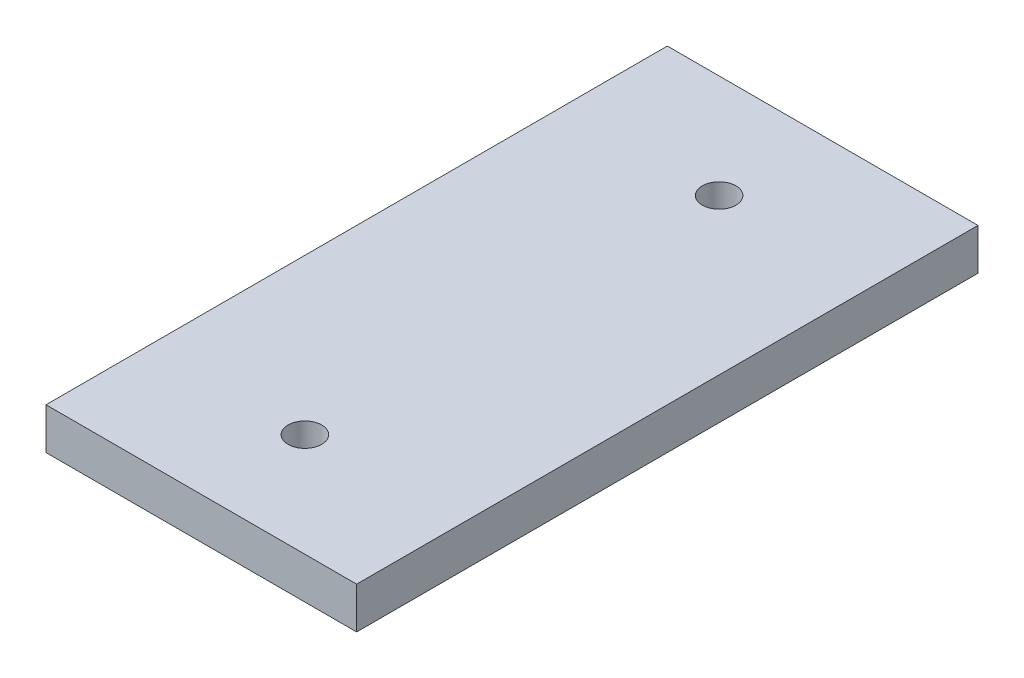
SolidWorks part; units mm, degrees
ref_plane "Face" through (0, 0, 0) normal (0, 0, 1) x (1, 0, 0)
ref_plane "Dessus" through (0, 0, 0) normal (0, 1, 0) x (1, 0, 0)
ref_plane "Droite" through (0, 0, 0) normal (1, 0, 0) x (0, 0, -1)
sketch "Esquisse1" plane through (0, 0, 0) normal (0, 0, 1) x (1, 0, 0)
  line L1 (0, 0) -> (60, 0)
  line L2 (0, 0) -> (0, -8)
  line L3 (0, -8) -> (60, -8)
  line L4 (60, 0) -> (60, -8)
  dimension "D1" = 60
  dimension "D2" = 8
extrude "Base-Extrusion" add sketch "Esquisse1" along normal blind 120
sketch "Esquisse2" plane through (0, 0, 0) normal (0, 1, 0) x (-1, 0, 0)
  line L0 (-60, 0) -> (0, 0) construction
  line L1 (-60, 120) -> (-60, 0) construction
  circle A0 centre (-30, 100) radius 3.25
  circle A1 centre (-30, 20) radius 3.25
  dimension "D2" = 6.5
  dimension "D1" = 80
  dimension "D3" = 20
  dimension "D4" = 30
extrude "Enlèv. mat.-Extru.1" cut sketch "Esquisse2" against normal blind 10
